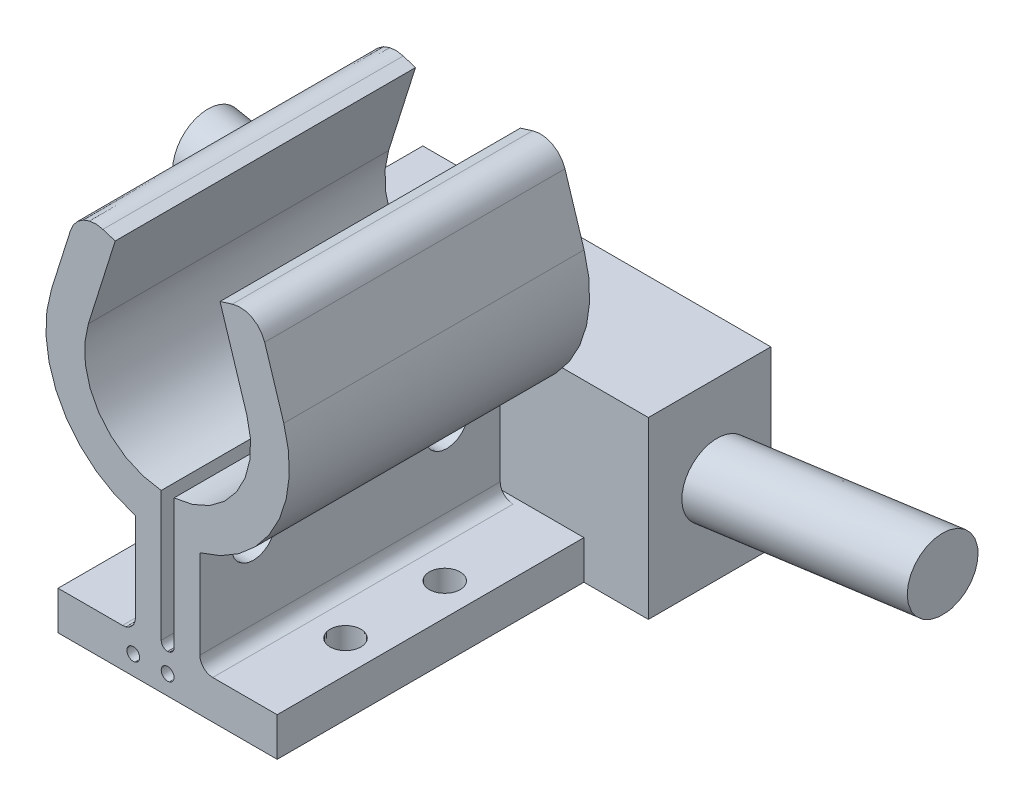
SolidWorks part; units mm, degrees
ref_plane "Front Plane" through (0, 0, 0) normal (0, 0, 1) x (1, 0, 0)
ref_plane "Top Plane" through (0, 0, 0) normal (0, 1, 0) x (1, 0, 0)
ref_plane "Right Plane" through (0, 0, 0) normal (1, 0, 0) x (0, 0, -1)
sketch "Sketch27" plane through (0, 0, 0) normal (0, 0, 1) x (1, 0, 0)
  line L0 (-4.0675, 8.55) -> (-3.5, 10.35) construction
  line L1 (0, -1000) -> (0, 49000) construction
  line L2 (-3.5, 10.35) -> (3.5, 10.35) construction
  line L3 (-4.0675, 8.55) -> (4.0675, 8.55) construction
  line L4 (3.5, 10.35) -> (4.0675, 8.55) construction
  line L5 (-6.1515, 1.9393) -> (-4.0675, 8.55)
  line L6 (6.1515, 1.9393) -> (4.0675, 8.55)
  line L7 (4.0675, 8.55) -> (-4.0675, 8.55) construction
  arc A0 (-6.1515, 1.9393) -> (6.1515, 1.9393) centre (0, 0) ccw
  point P9 (0, -6.45)
  dimension "D1" = 12.9
  dimension "D2" = 15
  dimension "D3" = 16.8
  dimension "D4" = 7
extrude "Extrude-Thin1" add sketch "Sketch27" along normal mid plane 23.3 thin
sketch "Sketch28" plane through (0, 0, 0) normal (0, 0, 1) x (1, 0, 0)
  line L0 (-2.5, -6.45) -> (-2.5, -17)
  line L1 (-2.5, -17) -> (-8.5, -17)
  line L2 (-8.5, -17) -> (-8.5, -20)
  line L3 (-8.5, -20) -> (8.5, -20)
  line L4 (8.5, -20) -> (8.5, -17)
  line L5 (8.5, -17) -> (2.5, -17)
  line L6 (2.5, -17) -> (2.5, -6.45)
  line L7 (2.5, -6.45) -> (-2.5, -6.45)
  line L8 (0, -1000) -> (0, 49000) construction
  line L9 (55, 0) -> (-55, 0) construction
  arc A0 (-6.1515, 1.9393) -> (6.1515, 1.9393) centre (0, 0) ccw construction
  dimension "D1" = 20
  dimension "D2" = 3
  dimension "D3" = 5
  dimension "D4" = 17
extrude "Boss-Extrude2" add sketch "Sketch28" along normal up to surface and the other way up to surface
sketch "Sketch29" plane through (0, 0, 0) normal (0, 0, 1) x (1, 0, 0)
  line L0 (0, -12.815) -> (0, 12.815) construction
  line L1 (-0.5, -17) -> (0.5, -17)
  line L2 (-0.5, -17) -> (-0.5, 0)
  line L3 (-0.5, 0) -> (0.5, 0)
  line L4 (0.5, -17) -> (0.5, 0)
  line L5 (-0.5, -17) -> (0.5, 0) construction
  line L6 (-0.5, 0) -> (0.5, -17) construction
  line L7 (10.3675, 0) -> (-10.3675, 0) construction
  point P0 (0, -8.5)
  dimension "D1" = 1
  dimension "D2" = 17
extrude "Cut-Extrude3" cut sketch "Sketch29" against normal through all both and the other way through all
sketch "Sketch4" plane through (0, 0, 0) normal (0, -1, 0) x (1, 0, 0)
  line L0 (-6, -3.85) -> (-6, 3.85) construction
  line L7 (-6, 3.85) -> (6, 3.85) construction
  line L8 (6, 3.85) -> (6, -3.85) construction
  line L9 (6, -3.85) -> (-6, -3.85) construction
  line L10 (-6, -3.85) -> (6, 3.85) construction
  line L11 (6, -3.85) -> (-6, 3.85) construction
  point P8 (6, -3.85)
  point P9 (6, 3.85)
  point P10 (-6, 3.85)
  point P11 (-6, -3.85)
  dimension "D1" = 12
  dimension "D2" = 7.7
hole_wizard "M2 Clearance Hole1" positions "Sketch19" profile "Sketch20" hole size "M2" standard "ANSI Metric"
sketch "Sketch19" plane through (0, -17, 0) normal (0, 1, 0) x (1, 0, 0)
  point P12 (-6, -3.85)
  point P15 (6, -3.85)
  point P21 (6, 3.85)
  point P23 (-6, 3.85)
sketch "Sketch20" plane through (-6, -17, 3.85) normal (1, 0, 0) x (0, 0, 1)
  line L0 (0, 0) -> (0, 3)
  line L1 (0, 3) -> (1.2, 3)
  line L2 (1.2, 3) -> (1.2, 0)
  line L5 (1.2, 0) -> (0, 0)
  line L11 (0, -6.35) -> (0, 107.95) construction
  dimension "Thru Hole Dia." = 2.4
  dimension "Thru Hole Depth" = 3
fillet "Fillet1" radius 1 2 edges at (2.5, -17, 0) (-2.5, -17, 0)
fillet "Fillet2" radius 0.5 2 edges at (-0.5, -17, 0) (0.5, -17, 0)
sketch "Sketch30" plane through (2.5, 0, 0) normal (1, 0, 0) x (0, 0, -1)
  line L0 (-7.5, -10) -> (7.5, -10) construction
  line L1 (0, 0) -> (0, -10) construction
  line L2 (10.395, 0) -> (-10.395, 0) construction
  circle A0 centre (-7.5, -10) radius 3
  circle A1 centre (7.5, -10) radius 3
  dimension "D1" = 6
  dimension "D2" = 15
  dimension "D3" = 10
extrude "Cut-Extrude4" cut sketch "Sketch30" along normal through all
hole_wizard "M3 Clearance Hole1" positions "Sketch31" profile "Sketch32" hole size "M3" standard "ANSI Metric"
sketch "Sketch31" plane through (2.5, 0, 0) normal (1, 0, 0) x (0, 0, -1)
  point P0 (-7.5, -10)
  point P3 (7.5, -10)
sketch "Sketch32" plane through (2.5, -10, 7.5) normal (0, 1, 0) x (0, 0, -1)
  line L0 (0, 0) -> (0, 11.95)
  line L1 (0, 11.95) -> (1.7, 11.95)
  line L2 (1.7, 11.95) -> (1.7, 0)
  line L5 (1.7, 0) -> (0, 0)
  line L11 (0, -6.35) -> (0, 107.95) construction
  dimension "Thru Hole Dia." = 3.4
  dimension "Thru Hole Depth" = 11.95
sketch "Sketch36" plane through (-2.5, 0, 0) normal (-1, 0, 0) x (0, 0, 1)
  line L1 (-5.8257, -12.9) -> (-4.1514, -10)
  line L2 (-4.1514, -10) -> (-5.8257, -7.1)
  line L3 (-5.8257, -7.1) -> (-9.1743, -7.1)
  line L4 (-9.1743, -7.1) -> (-10.8486, -10)
  line L5 (-10.8486, -10) -> (-9.1743, -12.9)
  line L6 (-9.1743, -12.9) -> (-5.8257, -12.9)
  line L7 (5.8257, -12.9) -> (9.1743, -12.9)
  line L8 (9.1743, -12.9) -> (10.8486, -10)
  line L9 (10.8486, -10) -> (9.1743, -7.1)
  line L10 (9.1743, -7.1) -> (5.8257, -7.1)
  line L11 (5.8257, -7.1) -> (4.1514, -10)
  line L12 (4.1514, -10) -> (5.8257, -12.9)
  circle A0 centre (-7.5, -10) radius 2.9 construction
  circle A1 centre (7.5, -10) radius 2.9 construction
  dimension "D1" = 5.8
extrude "Cut-Extrude5" cut sketch "Sketch36" along normal through all
fillet "Fillet3" radius 2 2 edges at (6.9287, 9.452, 0) (-6.9287, 9.452, 0)
sketch "Sketch37" plane through (0, 0, -11.65) normal (0, 0, -1) x (-1, 0, 0)
  line L1 (-8.5, -20) -> (-0.5, -20)
  line L2 (-8.5, -20) -> (-8.5, -6.4306)
  line L3 (-8.5, -6.4306) -> (-0.5, -6.4306)
  line L4 (-0.5, -20) -> (-0.5, -6.4306)
extrude "Boss-Extrude3" add sketch "Sketch37" along normal blind 10
sketch "Sketch38" plane through (8.5, 0, 0) normal (1, 0, 0) x (0, 0, -1)
  line L0 (21.65, -6.4306) -> (11.65, -6.4306) construction
  line L3 (21.65, -6.4306) -> (21.65, -20) construction
  circle A0 centre (16.65, -13.1806) radius 2.75
  dimension "D1" = 5.5
  dimension "D2" = 6.75
  dimension "D3" = 5
sketch "Sketch40" plane through (0, 0, -11.65) normal (0, 0, -1) x (-1, 0, 0)
  line L1 (8.5, -20) -> (0.5, -20)
  line L2 (8.5, -20) -> (8.5, -6.4306)
  line L3 (8.5, -6.4306) -> (0.5, -6.4306)
  line L4 (0.5, -20) -> (0.5, -6.4306)
extrude "Boss-Extrude6" add sketch "Sketch40" along normal blind 10
sketch "Sketch41" plane through (-8.5, 0, 0) normal (-1, 0, 0) x (0, 0, 1)
  line L0 (-21.65, -20) -> (-21.65, -6.4306) construction
  line L1 (-21.65, -6.4306) -> (-11.65, -6.4306) construction
  circle A0 centre (-16.65, -13.1806) radius 2.75
  dimension "D1" = 5.5
  dimension "D2" = 5
  dimension "D3" = 6.75
sketch "Sketch42" plane through (0, 0, -21.65) normal (0, 0, -1) x (-1, 0, 0)
  line L0 (0.5, -6.4306) -> (0.5, -20) construction
  line L1 (-0.5, -6.4306) -> (0.5, -6.4306)
  line L2 (-0.5, -6.4306) -> (-0.5, -20)
  line L3 (-0.5, -20) -> (0.5, -20)
  line L4 (0.5, -6.4306) -> (0.5, -20)
extrude "Boss-Extrude8" add sketch "Sketch42" against normal blind 10
sketch "Sketch44" plane through (8.5, 0, 0) normal (1, 0, 0) x (0, 0, -1)
  line L0 (21.65, -6.4306) -> (11.65, -6.4306) construction
  line L1 (11.65, -17) -> (12.15, -17)
  line L2 (11.65, -17) -> (11.65, -6.4306)
  line L3 (11.65, -6.4306) -> (12.15, -6.4306)
  line L4 (12.15, -17) -> (12.15, -6.4306)
  dimension "D1" = 0.5
extrude "Cut-Extrude6" cut sketch "Sketch44" against normal up to next
sketch "Sketch45" plane through (0, 0, -21.65) normal (0, 0, -1) x (-1, 0, 0)
  line L0 (-8.5, -20) -> (8.5, -20) construction
  point P0 (0, -18.5)
  point P3 (2.6668, -18.5)
  dimension "D1" = 1.5
hole_wizard "Ø1.0mm Transitional Dowel Hole1" positions "Sketch46" profile "Sketch47" hole size "Ø1.0" standard "ANSI Metric"
sketch "Sketch46" plane through (0, 0, -21.65) normal (0, 0, -1) x (-1, 0, 0)
  point P0 (0, -18.5)
  point P3 (2.6668, -18.5)
sketch "Sketch47" plane through (0, -18.5, -21.65) normal (1, 0, 0) x (0, 1, 0)
  line L0 (0, 0) -> (0, 33.3)
  line L1 (0, 33.3) -> (0.5, 33.3)
  line L2 (0.5, 33.3) -> (0.5, 0)
  line L5 (0.5, 0) -> (0, 0)
  line L11 (0, -6.35) -> (0, 107.95) construction
  dimension "Thru Hole Dia." = 1
  dimension "Thru Hole Depth" = 33.3
sketch3d "3DSketch1"
  circle A0 centre (-28.5, -13.3588, -19.9838) radius 2.75
  point P2 (-31.25, -13.3588, -19.9838)
  dimension "D2" = 5.5
  dimension "D1" = 20
loft "Loft2" add profiles "Sketch41", "3DSketch1"
mirror "Mirror1" about plane through (0, 0, 0) normal (1, 0, 0) of "Loft2"
sketch "Sketch48" plane through (-8.5, 0, 0) normal (-1, 0, 0) x (0, 0, 1)
  line L1 (-21.65, -20) -> (-12.15, -20)
  line L2 (-21.65, -20) -> (-21.65, -6.4306)
  line L3 (-21.65, -6.4306) -> (-12.15, -6.4306)
  line L4 (-12.15, -20) -> (-12.15, -6.4306)
extrude "Boss-Extrude9" add sketch "Sketch48" along normal blind 5
sketch "Sketch49" plane through (8.5, 0, 0) normal (1, 0, 0) x (0, 0, -1)
  line L1 (21.65, -20) -> (12.15, -20)
  line L2 (21.65, -20) -> (21.65, -6.4306)
  line L3 (21.65, -6.4306) -> (12.15, -6.4306)
  line L4 (12.15, -20) -> (12.15, -6.4306)
extrude "Boss-Extrude10" add sketch "Sketch49" along normal blind 5
sketch "Sketch50" plane through (0, -6.4306, 0) normal (0, 1, 0) x (1, 0, 0)
  point P0 (0, 16.8576)
hole_wizard "M4x0.7 Tapped Hole1" positions "Sketch51" profile "Sketch53" tap size "M4x0.7" standard "ANSI Metric"
sketch "Sketch51" plane through (0, -6.4306, 0) normal (0, 1, 0) x (1, 0, 0)
  point P0 (0, 16.8576)
sketch "Sketch53" plane through (0, -6.4306, -16.8576) normal (1, 0, 0) x (0, 0, 1)
  line L0 (0, 0) -> (0, 13.5694)
  line L1 (0, 13.5694) -> (1.65, 13.5694)
  line L2 (1.65, 13.5694) -> (1.65, 0)
  line L5 (1.65, 0) -> (0, 0)
  line L11 (0, -6.35) -> (0, 107.95) construction
  dimension "Thru Tap Drill Dia." = 3.3
  dimension "Thru Tap Drill Depth" = 13.5694
